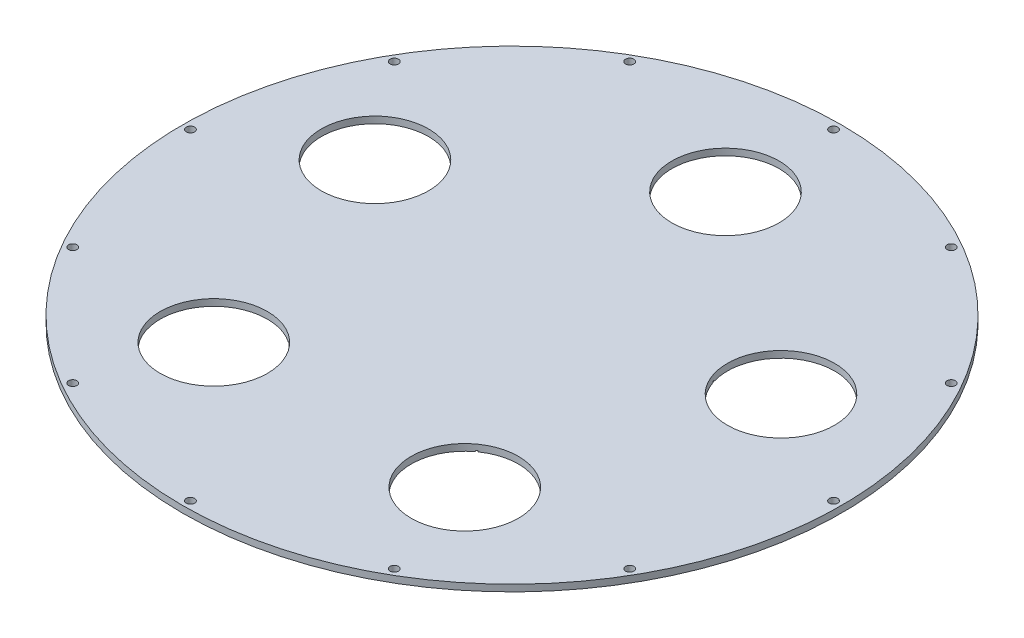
SolidWorks part; units mm, degrees
ref_plane "Front Plane" through (0, 0, 0) normal (0, 0, 1) x (1, 0, 0)
ref_plane "Top Plane" through (0, 0, 0) normal (0, 1, 0) x (1, 0, 0)
ref_plane "Right Plane" through (0, 0, 0) normal (1, 0, 0) x (0, 0, -1)
imported_body "Sun 20T"
imported_body "Planet 12T"
imported_body "Planet 12T 1"
imported_body "Planet 12T 2"
imported_body "Planet 12T 3"
imported_body "Planet 12T 5"
sketch "Planet Position" plane through (0, 6.35, 0) normal (0, 1, 0) x (1, 0, 0)
  line L0 (-96.6273, 31.3961) -> (-10.2745, 3.3384) construction
  line L1 (-96.6273, 31.3961) -> (-59.719, -82.1961) construction
  line L2 (-59.719, -82.1961) -> (59.719, -82.1961) construction
  line L3 (59.719, -82.1961) -> (96.6273, 31.3961) construction
  line L4 (96.6273, 31.3961) -> (0, 101.6) construction
  line L5 (0, 101.6) -> (-96.6273, 31.3961) construction
  line L6 (0, 0) -> (-3.7324, -5.1373) construction
  line L7 (0, 101.6) -> (0, 10.8033) construction
  line L8 (0, 0) -> (6.0392, 1.9623) construction
  line L9 (59.719, -82.1961) -> (6.35, -8.74) construction
  line L10 (-6.35, -8.74) -> (-59.719, -82.1961) construction
  line L11 (6.35, -8.74) -> (59.719, -82.1961) construction
  line L12 (10.2745, 3.3384) -> (96.6273, 31.3961) construction
  line L13 (-10.2745, 3.3384) -> (-96.6273, 31.3961) construction
  line L14 (0, 10.8033) -> (0, 101.6) construction
  line L15 (-59.719, -82.1961) -> (-113.088, -155.6522) construction
  line L16 (-6.35, -8.74) -> (-59.719, -82.1961) construction
  line L17 (-182.9802, 59.4539) -> (-96.6273, 31.3961) construction
  line L18 (0, 101.6) -> (0, 192.3967) construction
  line L19 (96.6273, 31.3961) -> (182.9802, 59.4539) construction
  line L20 (59.719, -82.1961) -> (113.088, -155.6522) construction
  line L21 (3.7324, -5.1373) -> (0, 0) construction
  line L22 (10.2745, 3.3384) -> (96.6273, 31.3961) construction
  line L23 (0, 6.35) -> (0, 0) construction
  line L24 (-6.0392, 1.9623) -> (0, 0) construction
  circle A0 centre (0, 0) radius 6.35 construction
  circle A1 centre (6.35, -8.74) radius 6.35 construction
  circle A2 centre (10.2745, 3.3384) radius 6.35 construction
  circle A3 centre (0, 10.8033) radius 6.35 construction
  circle A4 centre (-10.2745, 3.3384) radius 6.35 construction
  circle A5 centre (-6.35, -8.74) radius 6.35 construction
  circle A6 centre (0, 0) radius 192.3967 construction
  dimension "D1" = 12.7
  dimension "D2" = 384.7935
sketch "Sketch1" plane through (0, 6.35, 0) normal (0, 1, 0) x (1, 0, 0)
  line L0 (0, -149.225) -> (0, -156.845) construction
  circle A0 centre (0, 0) radius 149.225
  circle A1 centre (0, 0) radius 156.845
  circle A2 centre (-59.719, -82.1961) radius 25.527
  circle A3 centre (59.719, -82.1961) radius 25.527
  circle A4 centre (96.6273, 31.3961) radius 25.527
  circle A5 centre (0, 101.6) radius 25.527
  circle A6 centre (-96.6273, 31.3961) radius 25.527
  circle A7 centre (0, 0) radius 153.035 construction
  circle A8 centre (0, -153.035) radius 2
  circle A9 centre (-76.5175, -132.5322) radius 2
  circle A10 centre (-132.5322, -76.5175) radius 2
  circle A11 centre (-153.035, 0) radius 2
  circle A12 centre (-132.5322, 76.5175) radius 2
  circle A13 centre (-76.5175, 132.5322) radius 2
  circle A14 centre (0, 153.035) radius 2
  circle A15 centre (76.5175, 132.5322) radius 2
  circle A16 centre (132.5322, 76.5175) radius 2
  circle A17 centre (153.035, 0) radius 2
  circle A18 centre (132.5322, -76.5175) radius 2
  circle A19 centre (76.5175, -132.5322) radius 2
  point P22 (0, -153.035)
  point P26 (0, 0)
  point P51 (0, 0)
  dimension "D1" = 298.45
  dimension "D3" = 51.054
  dimension "D4" = 4
  dimension "D2" = 7.62
  dimension "D5" = 12
extrude "Plane" add sketch "Sketch1" along normal blind 3.175 separate body contours A0 A6 A5 A4 A3 M2 M49 M48 M47 M46 M45 M44 M43 M42 M41 M40 M39 M38 M37 M36 M35 M34 M33 M32 M31 M30 M29 M28 M27 M26 M25 M24 M23 M22 M21 M20 M19 M18 M17 M16 M15 M14 M13 M12 M11 M10 | M49 M2 M3 M4 M5 M6 M7 M8 M9 M10 M11 M12 M13 M14 M15 M16 M17 M18 M19 M20 M21 M22 M23 M24 M25 M26 M27 M28 M29 M30 M31 M32 M33 M34 M35 M36 M37 M38 M39 M40 M41 M42 M43 M44 M45 M46 M47 M48 M1 | A1 A0
sketch "Sketch2" plane through (0, 6.35, 0) normal (0, -1, 0) x (1, 0, 0)
  line L0 (0, -101.6) -> (0, 0) construction
  line L1 (-96.6273, -31.3961) -> (0, 0) construction
  line L2 (-0.4445, -101.6) -> (0.4445, -101.6)
  line L3 (-59.719, 82.1961) -> (0, 0) construction
  line L4 (0, 0) -> (59.719, 82.1961) construction
  line L6 (96.6273, -31.3961) -> (0, 0) construction
  line L7 (0.4445, -101.6) -> (0.4445, -0.6118)
  line L8 (0.4445, -0.6118) -> (96.49, -31.8189)
  line L9 (96.49, -31.8189) -> (96.7647, -30.9734)
  line L10 (96.7647, -30.9734) -> (0.7192, 0.2337)
  line L11 (0.7192, 0.2337) -> (60.0786, 81.9349)
  line L12 (60.0786, 81.9349) -> (59.3594, 82.4574)
  line L13 (59.3594, 82.4574) -> (0, 0.7562)
  line L14 (0, 0.7562) -> (-59.3594, 82.4574)
  line L15 (-59.3594, 82.4574) -> (-60.0786, 81.9349)
  line L16 (-60.0786, 81.9349) -> (-0.7192, 0.2337)
  line L17 (-0.7192, 0.2337) -> (-97.1869, -31.1106)
  line L18 (-97.1869, -31.1106) -> (-96.9122, -31.956)
  line L19 (-96.9122, -31.956) -> (-0.4445, -0.6118)
  line L20 (-0.4445, -0.6118) -> (-0.4445, -101.6)
  line L21 (-2.54, -50.8) -> (2.54, -50.8)
  line L24 (0, -46.4006) -> (0, -50.8) construction
  line L27 (-31.9144, 39.6051) -> (-27.8046, 42.591)
  line L29 (47.5288, -18.1137) -> (49.0986, -13.2824)
  line L32 (-47.5288, -18.1137) -> (-49.0986, -13.2824)
  line L35 (31.9144, 39.6051) -> (27.8046, 42.591)
  line L37 (0, -55.1994) -> (-2.54, -50.8)
  line L38 (2.54, -50.8) -> (0, -55.1994)
  line L39 (-49.0986, -13.2824) -> (-52.4978, -17.0576)
  line L40 (-52.4978, -17.0576) -> (-47.5288, -18.1137)
  line L41 (-32.4454, 44.6573) -> (-31.9144, 39.6051)
  line L42 (-27.8046, 42.591) -> (-32.4454, 44.6573)
  line L43 (27.8046, 42.591) -> (32.4454, 44.6573)
  line L44 (32.4454, 44.6573) -> (31.9144, 39.6051)
  line L45 (52.4978, -17.0576) -> (47.5288, -18.1137)
  line L46 (49.0986, -13.2824) -> (52.4978, -17.0576)
  line L47 (0, -56.2154) -> (-3.4199, -50.292)
  line L48 (-3.4199, -50.292) -> (3.4199, -50.292) construction
  line L49 (3.4199, -50.292) -> (0, -56.2154)
  line L50 (53.464, -17.3715) -> (46.7737, -18.7936)
  line L51 (46.7737, -18.7936) -> (48.8873, -12.2886) construction
  line L52 (48.8873, -12.2886) -> (53.464, -17.3715)
  line L53 (33.0426, 45.4792) -> (32.3276, 38.6769)
  line L54 (32.3276, 38.6769) -> (26.7942, 42.6972) construction
  line L55 (26.7942, 42.6972) -> (33.0426, 45.4792)
  line L56 (-26.7942, 42.6972) -> (-33.0426, 45.4792)
  line L57 (-33.0426, 45.4792) -> (-32.3276, 38.6769)
  line L58 (-32.3276, 38.6769) -> (-26.7942, 42.6972) construction
  line L59 (-53.464, -17.3715) -> (-46.7737, -18.7936)
  line L60 (-46.7737, -18.7936) -> (-48.8873, -12.2886) construction
  line L61 (-48.8873, -12.2886) -> (-53.464, -17.3715)
  point P25 (-59.719, 82.1961)
  point P28 (59.719, 82.1961)
  point P29 (-97.0495, -31.5333)
  point P30 (0, -101.6)
  point P31 (96.6273, -31.3961)
  point P34 (0, -50.8)
  point P49 (0, -46.4006)
  point P50 (0, 0)
  point P51 (0, -46.4006)
  point P57 (0, 0)
  point P58 (0, -50.8)
  point P59 (0, -50.8)
  point P60 (0, -56.32)
  point P61 (0, -54.4551)
  dimension "D1" = 0.889
  dimension "D2" = 5.08
  dimension "D3" = 0.508
  dimension "D4" = 0.508
  dimension "D7" = 0.508
  dimension "D5" = 0.508
  dimension "D6" = 0.508
extrude "Cut-Extrude1" cut sketch "Sketch2" against normal blind 0.508 contours L61 L17 L19 L59 M21 | L19 L40 L32 | L39 L40 L19 L32 L17 | L32 L39 L17 | L11 L35 L13 L14 L27 L16 L17 L32 L19 L20 L21 L7 L8 L29 L10 | L57 L56 L14 L16 M38 | L14 L42 L41 L16 L27 | L27 L42 L14 | L16 L41 L27 | L44 L11 L35 | L44 L43 L13 L35 L11 | L43 L35 L13 | L45 L8 L29 | L46 L10 L29 L8 L45 | L46 L29 L10 | L10 L52 L50 L8 M23 | L13 L55 L53 L11 M24 | L7 L49 L47 L20 M22 | L37 L20 L21 | L38 L21 L7 | L38 L7 L21 L20 L37
delete or keep bodies "Body-Delete/Keep 1" type delete bodies bodies 101 102 103 104 105 106
